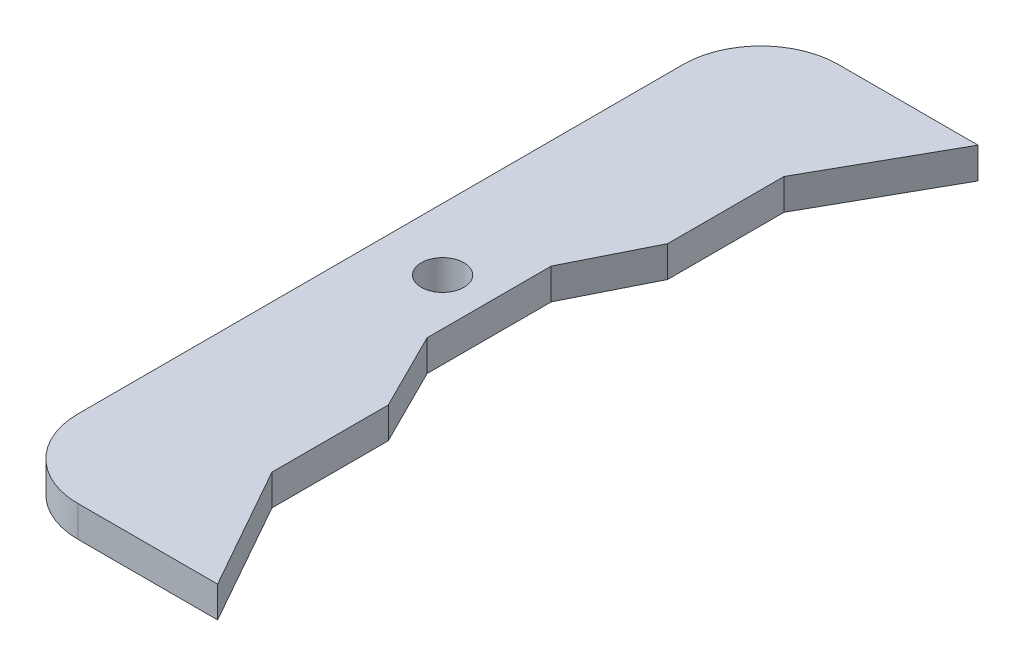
SolidWorks part; units mm, degrees
ref_plane "Front Plane" through (0, 0, 0) normal (0, 0, 1) x (1, 0, 0)
ref_plane "Top Plane" through (0, 0, 0) normal (0, 1, 0) x (1, 0, 0)
ref_plane "Right Plane" through (0, 0, 0) normal (1, 0, 0) x (0, 0, -1)
sketch "Sketch1" plane through (0, 0, 0) normal (0, 1, 0) x (1, 0, 0)
  line L0 (0, 49) -> (14, 49) construction
  line L1 (10, 0) -> (28, 0)
  line L2 (0, 10) -> (0, 88)
  line L3 (10, 98) -> (28, 98)
  line L4 (19, 31) -> (14, 41)
  line L5 (28, 98) -> (19, 82)
  line L6 (19, 82) -> (19, 67)
  line L7 (19, 67) -> (14, 57)
  line L8 (14, 57) -> (14, 41)
  line L9 (19, 16) -> (19, 31)
  line L10 (28, 0) -> (19, 16)
  arc A0 (0, 88) -> (10, 98) centre (10, 88) cw
  arc A1 (10, 0) -> (0, 10) centre (10, 10) cw
  circle A2 centre (8, 49) radius 2.75
  point P7 (0, 98)
  point P10 (0, 0)
  dimension "D3" = 10
  dimension "D4" = 8
  dimension "D5" = 5.5
  dimension "D1" = 98
  dimension "D2" = 28
  dimension "D6" = 8
  dimension "D7" = 5
  dimension "D8" = 10
  dimension "D9" = 15
  dimension "D10" = 16
  dimension "D11" = 19
extrude "Extrude1" add sketch "Sketch1" along normal blind 4
